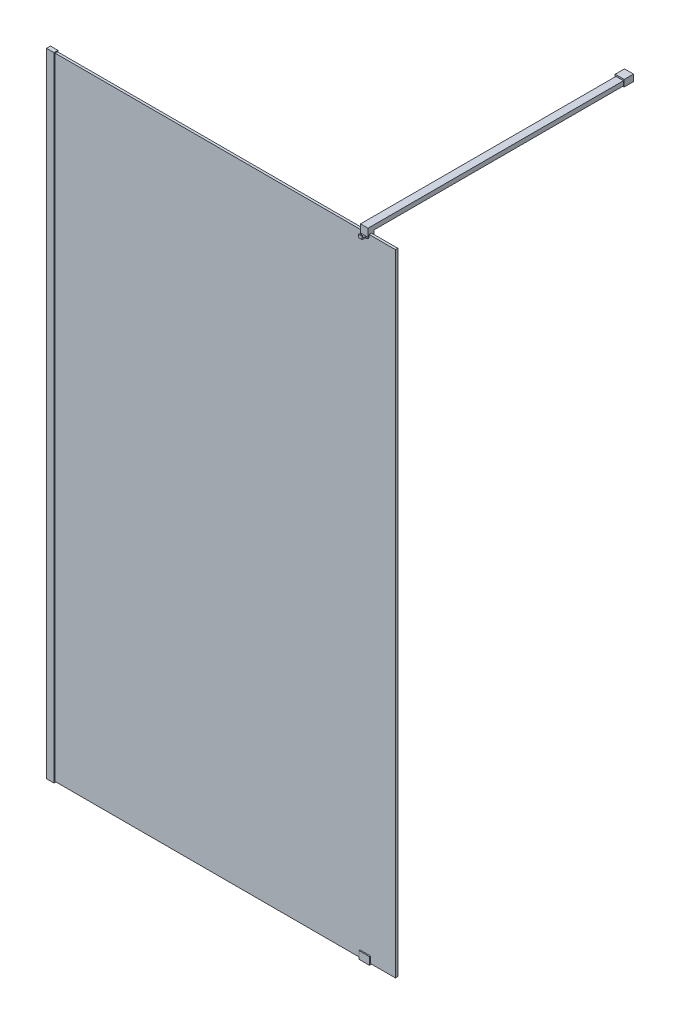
SolidWorks part; units mm, degrees
ref_plane "Płaszczyzna przednia" through (0, 0, 0) normal (0, 0, 1) x (1, 0, 0)
ref_plane "Płaszczyzna górna" through (0, 0, 0) normal (0, 1, 0) x (1, 0, 0)
ref_plane "Płaszczyzna prawa" through (0, 0, 0) normal (1, 0, 0) x (0, 0, -1)
sketch "Szkic1" plane through (0, 0, 0) normal (0, 1, 0) x (1, 0, 0)
  line L0 (0, 0) -> (0, 13.3)
  line L2 (0, 13.3) -> (25, 13.3)
  line L3 (25, 13.3) -> (25, 11.4)
  line L4 (25, 11.4) -> (11.45, 11.4)
  line L5 (11.45, 11.4) -> (11.45, 3.4)
  line L6 (11.45, 3.4) -> (25, 3.4)
  line L7 (25, 3.4) -> (25, 0)
  line L8 (25, 0) -> (0, 0)
  dimension "D1" = 13.3
  dimension "D4" = 1.9
  dimension "D5" = 8
  dimension "D6" = 3.4
  dimension "D7" = 13.55
  dimension "D8" = 25
extrude "Dodanie-wyciągnięcie1" add sketch "Szkic1" along normal blind 2100
sketch "Szkic2" plane through (0, 0, 0) normal (0, -1, 0) x (1, 0, 0)
  line L0 (11.45, -3.4) -> (1158.45, -3.4)
  line L1 (11.45, -3.4) -> (11.45, -11.4)
  line L2 (1158.45, -3.4) -> (1158.45, -11.4)
  line L3 (11.45, -11.4) -> (1158.45, -11.4)
  line L4 (11.45, -11.4) -> (25, -11.4) construction
  dimension "D1" = 1147
extrude "Dodanie-wyciągnięcie2" add sketch "Szkic2" against normal blind 2100 separate body
sketch "Szkic4" plane through (0, 2100, 0) normal (0, 1, 0) x (1, 0, 0)
  line L1 (25, 13.3) -> (0, 13.3) construction
  line L2 (25, 11.4) -> (25, 13.3) construction
  line L3 (0, 13.3) -> (0, 0) construction
  line L5 (0, 0) -> (25, 0) construction
  line L7 (25, 13.3) -> (0, 13.3)
  line L8 (25, 0) -> (25, 13.3)
  line L9 (0, 13.3) -> (0, 0)
  line L11 (0, 0) -> (25, 0)
extrude "Dodanie-wyciągnięcie3" add sketch "Szkic4" along normal blind 3
sketch "Szkic5" plane through (0, 0, 0) normal (0, -1, 0) x (1, 0, 0)
  line L1 (0, 0) -> (25, 0) construction
  line L2 (25, 0) -> (25, -3.4) construction
  line L3 (0, -13.3) -> (0, 0) construction
  line L5 (25, -13.3) -> (0, -13.3) construction
  line L7 (0, 0) -> (25, 0)
  line L8 (25, 0) -> (25, -13.3)
  line L9 (0, -13.3) -> (0, 0)
  line L11 (25, -13.3) -> (0, -13.3)
extrude "Dodanie-wyciągnięcie4" add sketch "Szkic5" along normal blind 3
ref_plane "Płaszczyzna1" through (1058.45, 0, 0) normal (1, 0, 0) x (0, 0, -1)
sketch "Szkic6" plane through (1058.45, 0, 0) normal (1, 0, 0) x (0, 0, -1)
  line L0 (11.4, 22) -> (15.75, 22)
  line L1 (15.75, 22) -> (15.75, -3)
  line L2 (15.75, -3) -> (-0.35, -3)
  line L3 (-0.35, -3) -> (-0.35, 22)
  line L4 (-0.35, 22) -> (3.4, 22)
  line L5 (11.4, 22) -> (11.4, 0)
  line L6 (11.4, 0) -> (11.4, 2100)
  line L7 (11.4, 0) -> (11.4, 2100) construction
  line L8 (3.4, 2100) -> (3.4, 0)
  line L9 (3.4, 2100) -> (3.4, 0) construction
  line L10 (11.4, 0) -> (3.4, 0)
  line L11 (3.4, 0) -> (3.4, 22)
  dimension "D1" = 4.35
  dimension "D2" = 25
  dimension "D3" = 3
  dimension "D4" = 3.75
extrude "Dodanie-wyciągnięcie5" add sketch "Szkic6" along normal mid plane 35 separate body
sketch "Szkic7" plane through (1058.45, 0, 0) normal (1, 0, 0) x (0, 0, -1)
  line L0 (3.4, 2100) -> (3.4, 0) construction
  line L1 (-0.6, 2120) -> (19.4, 2120)
  line L2 (3.4, 2100) -> (3.4, 0) construction
  line L4 (11.4, 2100) -> (3.4, 2100) construction
  line L13 (11.4, 2100) -> (11.4, 0) construction
  line L20 (19.4, 2120) -> (19.4, 2090)
  line L25 (19.4, 2090) -> (11.4, 2090)
  line L26 (11.4, 2090) -> (11.4, 2100)
  line L27 (11.4, 2100) -> (3.4, 2100)
  line L28 (3.4, 2100) -> (3.4, 2090)
  line L29 (3.4, 2090) -> (-13.37, 2090)
  line L30 (-13.37, 2090) -> (-13.37, 2100)
  line L31 (-13.37, 2100) -> (-10.37, 2100)
  line L32 (-10.37, 2100) -> (-9.8451, 2094)
  line L33 (-9.8451, 2094) -> (-0.6, 2094)
  line L34 (-0.6, 2094) -> (-0.6, 2120)
  dimension "D3" = 20
  dimension "D4" = 30
  dimension "D5" = 16.77
  dimension "D6" = 4
  dimension "D14" = 8
  dimension "D21" = 10
  dimension "D22" = 4
  dimension "D23" = 3
  dimension "D24" = 95
extrude "Dodanie-wyciągnięcie6" add sketch "Szkic7" along normal mid plane 25 separate body
sketch "Szkic8" plane through (0, 2100, 0) normal (0, 1, 0) x (1, 0, 0)
  line L0 (1045.95, -0.6) -> (1052.45, -3.631)
  line L1 (1052.45, -3.631) -> (1052.45, -13.37)
  line L2 (1070.95, -0.6) -> (1064.45, -3.631)
  line L3 (1064.45, -3.631) -> (1064.45, -13.37)
  line L4 (1058.45, -10.37) -> (1058.45, 156.6902) construction
  line L5 (1070.95, -10.37) -> (1045.95, -10.37) construction
  line L6 (1052.45, -13.37) -> (1064.45, -13.37)
  line L7 (1070.95, -13.37) -> (1045.95, -13.37) construction
  dimension "D1" = 12
  dimension "D2" = 115
extrude "Wytnij-wyciągnięcie1" cut sketch "Szkic8" against normal through all and the other way through all
sketch "Szkic10" plane through (0, 2120, 0) normal (0, 1, 0) x (1, 0, 0)
  line L0 (1058.45, 31.9) -> (1058.45, 19.4) construction
  line L1 (1045.95, 881.03) -> (1070.95, 881.03)
  line L2 (1045.95, 881.03) -> (1045.95, 19.4)
  line L3 (1045.95, 19.4) -> (1070.95, 19.4)
  line L4 (1070.95, 19.4) -> (1045.95, 19.4) construction
  line L5 (1045.95, 19.4) -> (1045.95, -0.6) construction
  line L6 (1070.95, 881.03) -> (1070.95, 19.4)
  point P4 (1058.45, 31.9)
  dimension "D2" = 861.63
  dimension "D1" = 25
  dimension "D3" = 12.5
extrude "Dodanie-wyciągnięcie7" add sketch "Szkic10" against normal blind 15
sketch "Szkic14" plane through (0, 0, -881.03) normal (0, 0, -1) x (-1, 0, 0)
  line L1 (-1073.45, 2125) -> (-1043.45, 2125)
  line L2 (-1073.45, 2125) -> (-1073.45, 2103)
  line L3 (-1073.45, 2103) -> (-1043.45, 2103)
  line L4 (-1043.45, 2125) -> (-1043.45, 2103)
  line L5 (-1073.45, 2125) -> (-1043.45, 2103) construction
  line L6 (-1073.45, 2103) -> (-1043.45, 2125) construction
  line L7 (-1058.45, 2120) -> (-1058.45, 2114) construction
  line L8 (-1070.95, 2120) -> (-1045.95, 2120) construction
  line L9 (-1070.95, 2105) -> (-1045.95, 2105) construction
  point P0 (-1058.45, 2114)
  dimension "D1" = 30
  dimension "D2" = 22
  dimension "D3" = 2
extrude "Dodanie-wyciągnięcie8" add sketch "Szkic14" against normal blind 31
